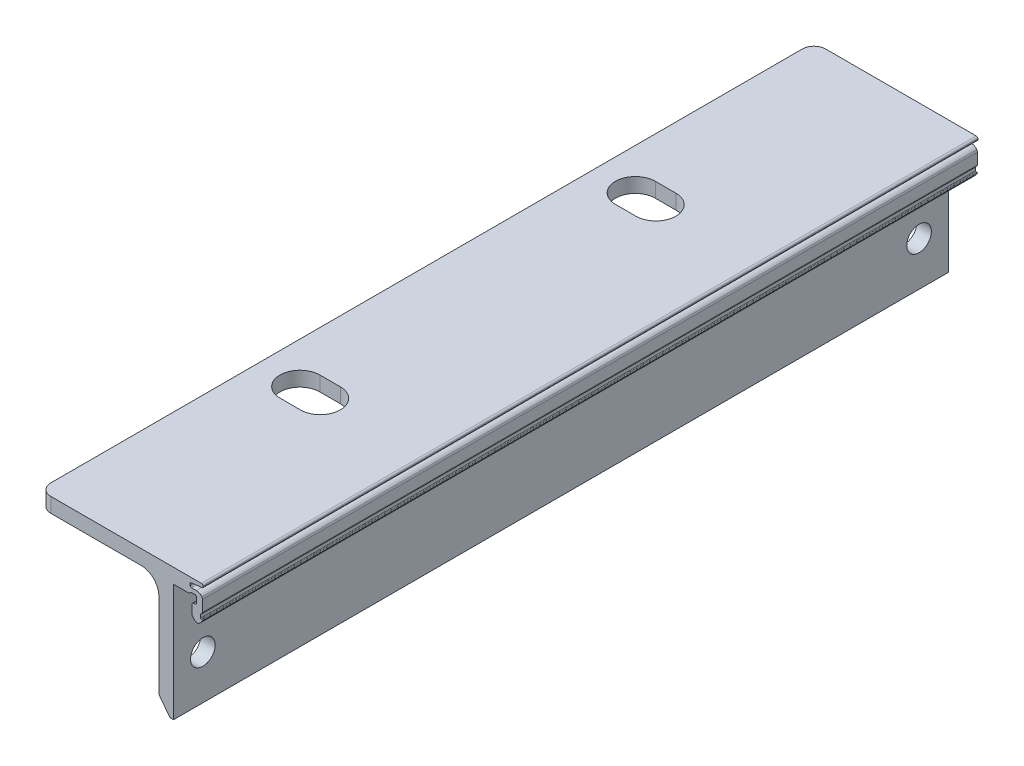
SolidWorks part; units mm, degrees
ref_plane "前视基准面" through (0, 0, 0) normal (0, 0, 1) x (1, 0, 0)
ref_plane "上视基准面" through (0, 0, 0) normal (0, 1, 0) x (1, 0, 0)
ref_plane "右视基准面" through (0, 0, 0) normal (1, 0, 0) x (0, 0, -1)
sketch "草图1" plane through (0, 0, 0) normal (0, 0, 1) x (1, 0, 0)
  line L0 (2329.984, -3290.1038) -> (2355.384, -3290.1038)
  line L1 (2329.984, -3292.6038) -> (2350.384, -3292.6038)
  line L2 (2352.884, -3292.6038) -> (2355.384, -3292.6038)
  line L3 (2350.384, -3292.6038) -> (2350.384, -3310.1038)
  line L4 (2352.884, -3292.6038) -> (2352.884, -3312.6038)
  line L5 (2355.384, -3292.6038) -> (2355.384, -3290.1038) construction
  line L6 (2355.384, -3290.1038) -> (2357.924, -3290.1038) construction
  line L8 (2329.984, -3290.1038) -> (2329.984, -3292.6038)
  line L10 (2352.884, -3312.6038) -> (2352.284, -3312.6038)
  line L11 (2350.384, -3310.1038) -> (2352.284, -3312.6038)
  line L12 (2356.524, -3292.3038) -> (2355.988, -3292.3038)
  line L13 (2357.5972, -3295.408) -> (2357.724, -3295.408)
  line L14 (2357.624, -3290.1038) -> (2357.924, -3290.1038) construction
  line L15 (2357.8006, -3295.5917) -> (2357.3831, -3296.0891)
  line L16 (2357.4972, -3294.808) -> (2357.4972, -3295.308)
  line L17 (2357.824, -3295.508) -> (2357.824, -3295.5274)
  line L18 (2357.824, -3292.376) -> (2357.824, -3294.2738)
  line L19 (2356.324, -3293.7038) -> (2356.524, -3293.7038)
  line L20 (2356.024, -3295.4545) -> (2356.024, -3294.0038)
  line L21 (2357.7449, -3290.6914) -> (2355.9031, -3290.8849)
  line L22 (2355.724, -3291.0839) -> (2355.724, -3291.4038)
  line L23 (2355.924, -3291.6038) -> (2356.77, -3291.6038)
  line L24 (2357.924, -3290.4038) -> (2357.924, -3290.4925)
  line L25 (2356.465, -3296.0891) -> (2356.0943, -3295.6474)
  line L26 (2356.824, -3293.4038) -> (2356.824, -3292.6038)
  line L27 (2357.924, -3290.4038) -> (2357.924, -3290.1038) construction
  line L28 (2355.384, -3292.6038) -> (2355.4683, -3292.6038)
  line L29 (2355.384, -3290.1038) -> (2357.624, -3290.1038)
  arc A0 (2357.4972, -3294.808) -> (2357.6606, -3294.5409) centre (2357.7972, -3294.808) cw
  arc A1 (2356.77, -3291.6038) -> (2357.7198, -3292.0704) centre (2356.77, -3292.8038) cw
  arc A2 (2357.824, -3295.5274) -> (2357.8006, -3295.5917) centre (2357.724, -3295.5274) cw
  arc A3 (2355.724, -3291.0839) -> (2355.9031, -3290.8849) centre (2355.924, -3291.0839) cw
  arc A4 (2357.924, -3290.4925) -> (2357.7449, -3290.6914) centre (2357.724, -3290.4925) cw
  arc A5 (2355.7282, -3292.4538) -> (2355.4683, -3292.6038) centre (2355.4683, -3292.3038) cw
  arc A6 (2357.624, -3290.1038) -> (2357.924, -3290.4038) centre (2357.624, -3290.4038) cw
  arc A7 (2357.5972, -3295.408) -> (2357.4972, -3295.308) centre (2357.5972, -3295.308) cw
  arc A8 (2357.824, -3294.2738) -> (2357.6606, -3294.5409) centre (2357.524, -3294.2738) cw
  arc A9 (2355.924, -3291.6038) -> (2355.724, -3291.4038) centre (2355.924, -3291.4038) cw
  arc A10 (2356.524, -3292.3038) -> (2356.824, -3292.6038) centre (2356.524, -3292.6038) cw
  arc A11 (2356.0943, -3295.6474) -> (2356.024, -3295.4545) centre (2356.324, -3295.4545) cw
  arc A12 (2355.7282, -3292.4538) -> (2355.988, -3292.3038) centre (2355.988, -3292.6038) cw
  arc A13 (2357.7198, -3292.0704) -> (2357.824, -3292.376) centre (2357.324, -3292.376) cw
  arc A14 (2356.024, -3294.0038) -> (2356.324, -3293.7038) centre (2356.324, -3294.0038) cw
  arc A15 (2356.824, -3293.4038) -> (2356.524, -3293.7038) centre (2356.524, -3293.4038) cw
  arc A16 (2357.3831, -3296.0891) -> (2356.465, -3296.0891) centre (2356.924, -3295.7038) cw
  arc A17 (2357.724, -3295.408) -> (2357.824, -3295.508) centre (2357.724, -3295.508) cw
  dimension "D1" = 20
  dimension "D2" = 0.6
  dimension "D3" = 2.5
  dimension "D4" = 20.4
  dimension "D5" = 127.235
extrude "凸台-拉伸1" add sketch "草图1" along normal mid plane 132
fillet "圆角2" radius 3 1 edges at (2350.384, -3292.6038, 0)
sketch "草图2" plane through (0, -3290.1038, 0) normal (0, 1, 0) x (1, 0, 0)
  line L0 (2338.734, 31.975) -> (2338.734, 25.175) construction
  line L3 (2370.3278, 0) -> (2329.984, 0) construction
  line L5 (2329.984, -66) -> (2329.984, 66) construction
  line L6 (2340.484, -25.175) -> (2336.984, -25.175)
  line L7 (2340.484, -31.975) -> (2336.984, -31.975)
  line L9 (2340.484, 31.975) -> (2336.984, 31.975)
  line L10 (2340.484, 25.175) -> (2336.984, 25.175)
  arc A0 (2336.984, -31.975) -> (2336.984, -25.175) centre (2336.984, -28.575) cw
  arc A1 (2336.984, 31.975) -> (2336.984, 25.175) centre (2336.984, 28.575) ccw
  arc A2 (2340.484, -25.175) -> (2340.484, -31.975) centre (2340.484, -28.575) cw
  arc A4 (2340.484, 25.175) -> (2340.484, 31.975) centre (2340.484, 28.575) ccw
  dimension "D4" = 8.75
  dimension "D1" = 57.15
  dimension "D5" = 3.5
  dimension "D6" = 3.4
extrude "切除-拉伸1" cut sketch "草图2" against normal through all
sketch "草图3" plane through (2350.384, 0, 0) normal (-1, 0, 0) x (0, 0, 1)
  line L0 (-66, -3295.6038) -> (-66, -3310.1038) construction
  line L1 (66, -3290.1038) -> (-66, -3290.1038) construction
  line L2 (0, -3290.1038) -> (0, -3328.2905) construction
  circle A0 centre (-61, -3305.1038) radius 2.1
  circle A1 centre (61, -3305.1038) radius 2.1
  dimension "D1" = 4.2
  dimension "D2" = 5
  dimension "D3" = 15
extrude "切除-拉伸2" cut sketch "草图3" against normal through all
fillet "圆角1" radius 2 2 edges at (2329.984, -3291.3538, -66) (2329.984, -3291.3538, 66)
sketch "草图4" plane through (0, -3290.1038, 0) normal (0, 1, 0) x (1, 0, 0)
  line L0 (2329.984, 0) -> (2357.624, 0) construction
  line L1 (2329.984, -64) -> (2329.984, 64) construction
  line L3 (2357.624, -66) -> (2357.624, 66) construction
  circle A0 centre (2339.984, 124) radius 2.1
  circle A1 centre (2339.984, -124) radius 2.1
  dimension "D1" = 4.2
  dimension "D3" = 10
  dimension "D5" = 248
  dimension "D4" = 2
extrude "切除-拉伸5" [suppressed] cut sketch "草图4" against normal through all
chamfer "倒角1" [suppressed] distance 2 angle 45
